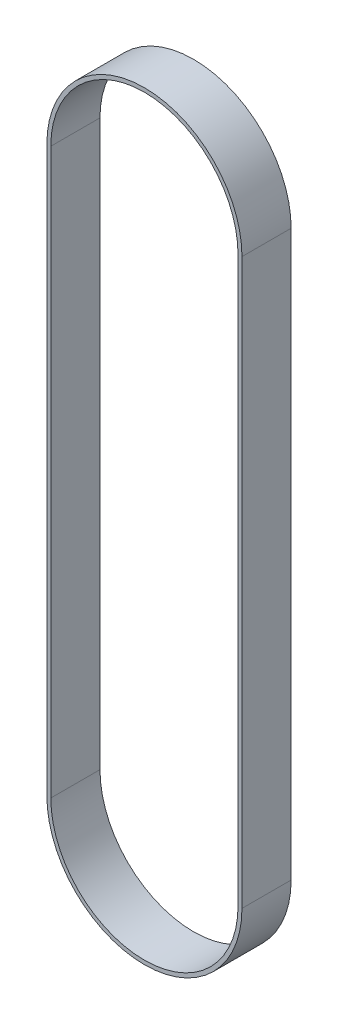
SolidWorks part; units mm, degrees
ref_plane "Front Plane" through (0, 0, 0) normal (0, 0, 1) x (1, 0, 0)
ref_plane "Top Plane" through (0, 0, 0) normal (0, 1, 0) x (1, 0, 0)
ref_plane "Right Plane" through (0, 0, 0) normal (1, 0, 0) x (0, 0, -1)
sketch "Sketch1" plane through (0, 0, 0) normal (0, 0, 1) x (1, 0, 0)
  line L0 (-60.452, 0) -> (-60.452, -364.49)
  line L1 (60.452, 0) -> (60.452, -364.49)
  line L2 (-62.992, 0) -> (-62.992, -364.49)
  line L3 (62.992, 0) -> (62.992, -364.49)
  arc A0 (60.452, 0) -> (-60.452, 0) centre (0, 0) ccw
  arc A1 (-60.452, -364.49) -> (60.452, -364.49) centre (0, -364.49) ccw
  arc A2 (62.992, 0) -> (-62.992, 0) centre (0, 0) ccw
  arc A3 (-62.992, -364.49) -> (62.992, -364.49) centre (0, -364.49) ccw
  dimension "D1" = 364.49
  dimension "D3" = 60.452
  dimension "D2" = 2.54
extrude "Extrude1" add sketch "Sketch1" along normal blind 31.75
